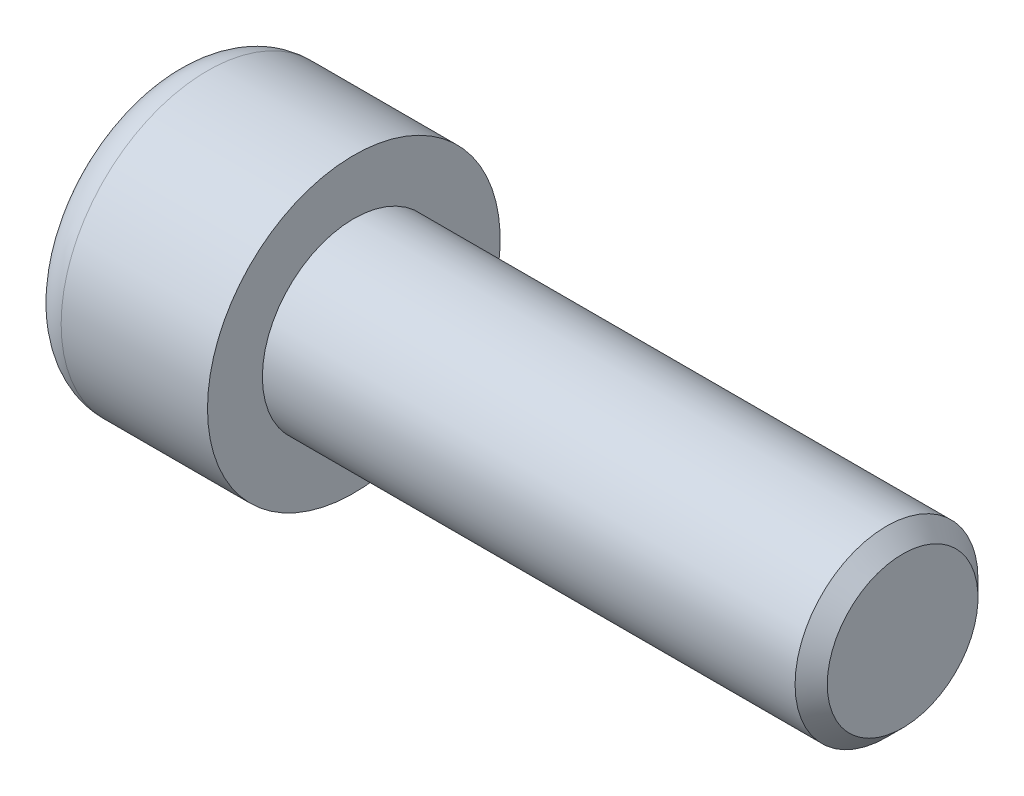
SolidWorks part; units mm, degrees
ref_plane "Plan1" through (0, 0, 0) normal (0, 0, 1) x (1, 0, 0)
ref_plane "Plan2" through (0, 0, 0) normal (0, 1, 0) x (1, 0, 0)
ref_plane "Plan3" through (0, 0, 0) normal (1, 0, 0) x (0, 0, -1)
sketch "Esquisse1" plane through (0, 0, 0) normal (0, 0, 1) x (1, 0, 0)
  line L0 (-18.865, 0) -> (43.9411, 0) construction
  line L1 (-12, 0) -> (-12, 8)
  line L2 (-12, 8) -> (-2, 8)
  line L3 (-2, 8) -> (-2, 5)
  line L4 (-2, 5) -> (28, 5)
  line L5 (28, 5) -> (28, 0)
  line L6 (-12, 0) -> (28, 0)
  dimension "D1" = 5
  dimension "D2" = 12
  dimension "D3" = 10
  dimension "D4" = 30
  dimension "D5" = 8
revolve "Base-Révolution" add sketch "Esquisse1"
chamfer "Chanfrein2" distance 0.88 angle 45
sketch "Esquisse2" plane through (-12, 0, 0) normal (-1, 0, 0) x (0, 0, 1)
  line L0 (0, 4.6188) -> (4, 2.3094)
  line L4 (4, 2.3094) -> (4, -2.3094)
  line L8 (0, -4.6188) -> (4, -2.3094)
  line L9 (-4, -2.3094) -> (0, -4.6188)
  line L10 (-4, 2.3094) -> (-4, -2.3094)
  line L11 (0, 4.6188) -> (-4, 2.3094)
  dimension "D1" = 4
  dimension "D2" = 8
extrude "Enlèv. mat.-Extru.1" cut sketch "Esquisse2" against normal blind 9
fillet "Congé1" radius 2
